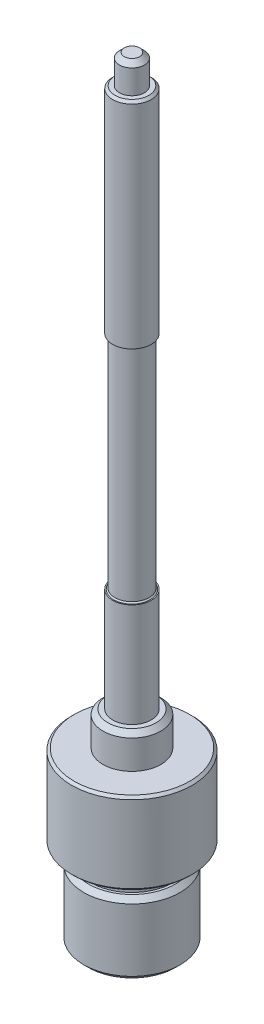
SolidWorks part; units mm, degrees
ref_plane "Front Plane" through (0, 0, 0) normal (0, 0, 1) x (1, 0, 0)
ref_plane "Top Plane" through (0, 0, 0) normal (0, 1, 0) x (1, 0, 0)
ref_plane "Right Plane" through (0, 0, 0) normal (1, 0, 0) x (0, 0, -1)
sketch "Sketch1" plane through (0, 0, 0) normal (1, 0, 0) x (0, 0, -1)
  line L0 (-6.9735, 85.417) -> (-6.9735, -44.583)
  line L1 (-6.9735, 85.417) -> (-9.5599, 85.417)
  line L2 (-11.9735, -47.583) -> (-6.9735, -44.583)
  line L3 (-10.9735, -11.083) -> (-10.5028, -11.083)
  line L4 (-12.9735, -39.583) -> (-12.9735, -32.583)
  line L5 (-12.9735, -32.583) -> (-10.9735, -32.583)
  line L6 (-10.5028, -11.083) -> (-10.5028, 34.917)
  line L7 (-10.5028, 34.917) -> (-10.9735, 34.917)
  line L8 (-10.9735, -11.083) -> (-10.9735, -32.583)
  line L10 (-10.9735, 79.417) -> (-10.9735, 34.917)
  line L12 (-10.9735, 79.417) -> (-9.5599, 79.417)
  line L13 (-12.9735, -39.583) -> (-19.4735, -39.583)
  line L14 (-19.4735, -39.583) -> (-19.4735, -56.583)
  line L15 (-19.4735, -56.583) -> (-15.4735, -56.583)
  line L16 (-15.4735, -56.583) -> (-15.4735, -59.583)
  line L17 (-15.4735, -59.583) -> (-16.9735, -59.583)
  line L18 (-16.9735, -59.583) -> (-16.9735, -74.583)
  line L19 (-16.9735, -74.583) -> (-14.9735, -74.583)
  line L20 (-14.9735, -74.583) -> (-11.9735, -60.583)
  line L21 (-11.9735, -60.583) -> (-11.9735, -47.583)
  line L22 (-9.5599, 79.417) -> (-9.5599, 85.417)
  dimension "D1" = 160
  dimension "D2" = 7
  dimension "D3" = 6
  dimension "D4" = 27
  dimension "D5" = 30
  dimension "D6" = 4
  dimension "D7" = 12.5
  dimension "D8" = 10
  dimension "D9" = 8.5
  dimension "D10" = 5
  dimension "D12" = 14
  dimension "D13" = 15
  dimension "D14" = 8
  dimension "D15" = 35
  dimension "D16" = 18
  dimension "D17" = 21.5
  dimension "D18" = 67.5
  dimension "D20" = 6
revolve "Revolve1" add sketch "Sketch1" angle 360 about L0
chamfer "Chamfer1" distance 1 angle 45 4 edges at (0, -32.583, 12.9735) (0, -59.583, 16.9735) (0, -74.583, 16.9735) (0, 85.417, 9.5599)
chamfer "Chamfer2" distance 0.5 angle 45 3 edges at (0, -39.583, 19.4735) (0, -56.583, 19.4735) (0, 79.417, 10.9735)
chamfer "Chamfer3" distance 0.25 angle 45 2 edges at (0, 34.917, 10.5028) (0, -11.083, 10.5028)
